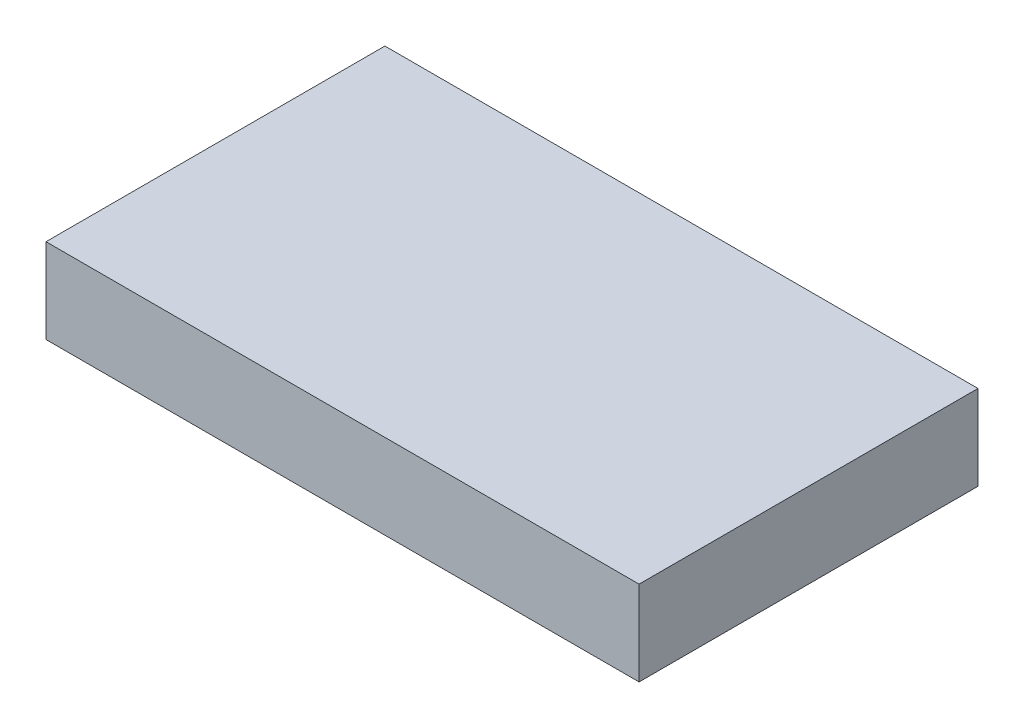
SolidWorks part; units mm, degrees
ref_plane "前视基准面" through (0, 0, 0) normal (0, 0, 1) x (1, 0, 0)
ref_plane "上视基准面" through (0, 0, 0) normal (0, 1, 0) x (1, 0, 0)
ref_plane "右视基准面" through (0, 0, 0) normal (1, 0, 0) x (0, 0, -1)
sketch "草图1" plane through (0, 0, 0) normal (0, 1, 0) x (1, 0, 0)
  line L0 (0, 0) -> (0, -101.1621) construction
  line L1 (-70, 0) -> (70, 0)
  line L2 (-70, 0) -> (-70, -80)
  line L3 (-70, -80) -> (70, -80)
  line L4 (70, 0) -> (70, -80)
  dimension "D1" = 140
  dimension "D2" = 80
extrude "拉伸1" add sketch "草图1" along normal blind 20
